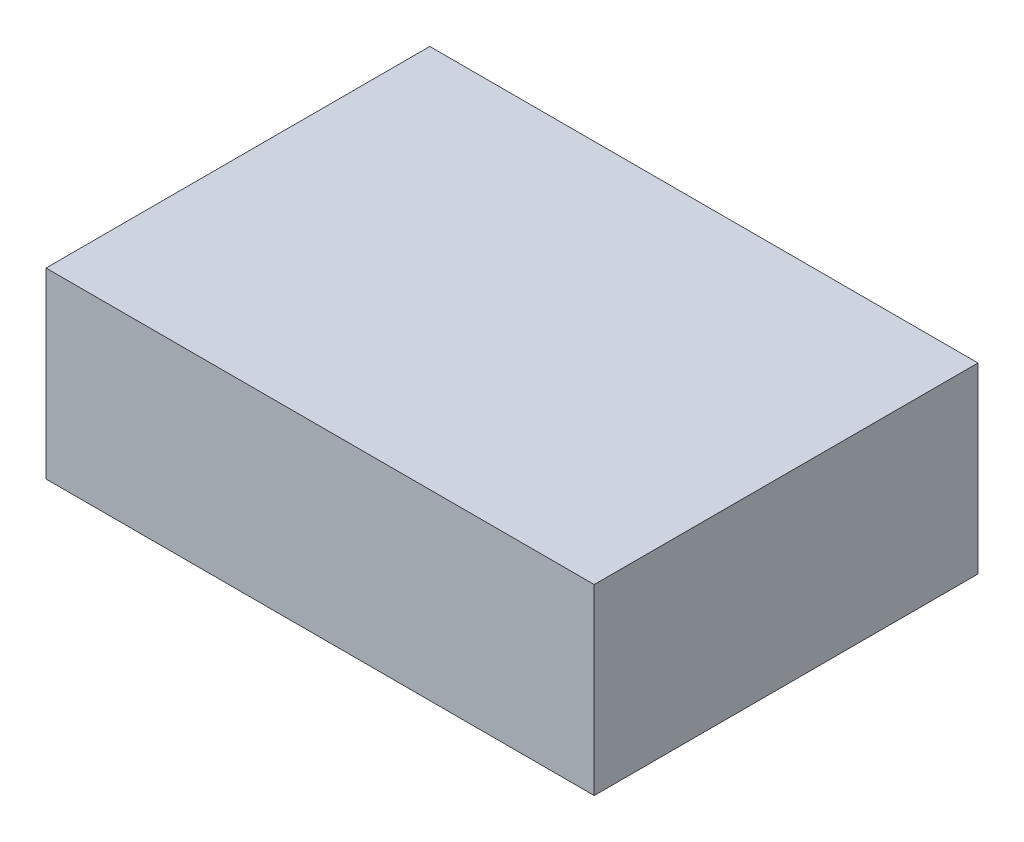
SolidWorks part; units mm, degrees
ref_plane "Front Plane" through (0, 0, 0) normal (0, 0, 1) x (1, 0, 0)
ref_plane "Top Plane" through (0, 0, 0) normal (0, 1, 0) x (1, 0, 0)
ref_plane "Right Plane" through (0, 0, 0) normal (1, 0, 0) x (0, 0, -1)
sketch "Sketch1" plane through (0, 0, 0) normal (0, 1, 0) x (1, 0, 0)
  line L1 (-356.2082, 67.5143) -> (-203.8082, 67.5143)
  line L2 (-356.2082, 67.5143) -> (-356.2082, -39.1657)
  line L3 (-356.2082, -39.1657) -> (-203.8082, -39.1657)
  line L4 (-203.8082, 67.5143) -> (-203.8082, -39.1657)
  dimension "D1" = 106.68
  dimension "D2" = 152.4
extrude "Extrude1" add sketch "Sketch1" along normal blind 50.8
